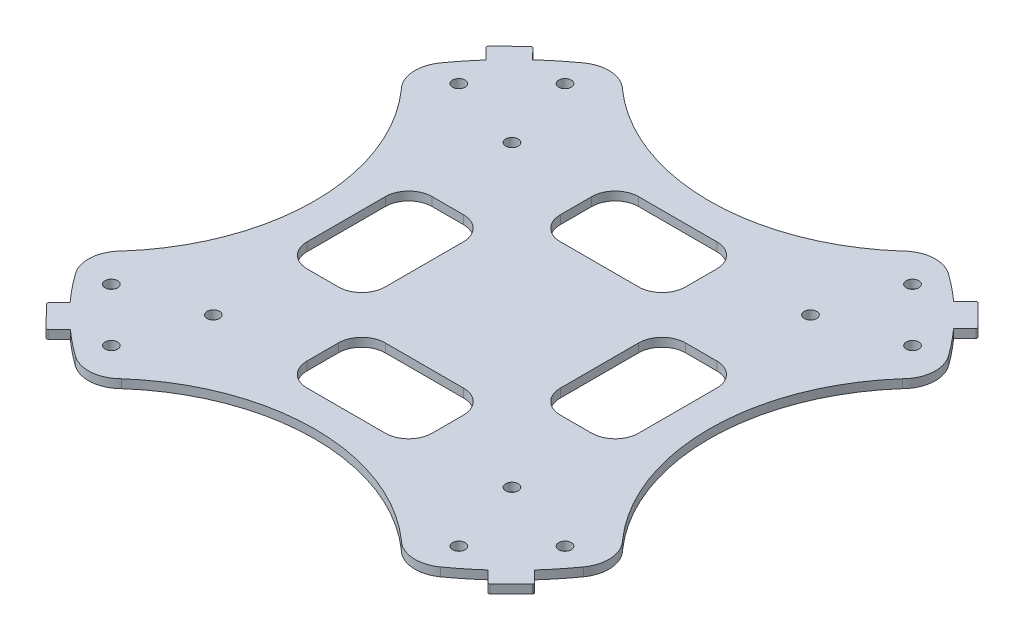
SolidWorks part; units mm, degrees
ref_plane "Front Plane" through (0, 0, 0) normal (0, 0, 1) x (1, 0, 0)
ref_plane "Top Plane" through (0, 0, 0) normal (0, 1, 0) x (1, 0, 0)
ref_plane "Right Plane" through (0, 0, 0) normal (1, 0, 0) x (0, 0, -1)
sketch "Sketch1" plane through (0, 0, 0) normal (0, 1, 0) x (1, 0, 0)
  line L0 (-1000, 0) -> (49000, 0) construction
  line L1 (0, -1000) -> (0, 49000) construction
  line L2 (707.1069, -707.1069) -> (-34648.2322, 34648.2322) construction
  line L3 (-707.1068, -707.1068) -> (34648.2323, 34648.2323) construction
  line L4 (716.0871, -698.1266) -> (0, 17.9605) construction
  line L5 (-698.1265, -716.087) -> (34657.2125, 34639.252) construction
  line L6 (698.1266, -716.0871) -> (-34657.2125, 34639.2519) construction
  line L7 (-716.087, -698.1265) -> (0, 17.9605) construction
  line L8 (-733.6258, -670.2104) -> (-31.7077, 31.7077) construction
  line L9 (733.9751, -670.5597) -> (22.7274, 40.6879) construction
  line L10 (39.5829, 36.115) -> (36.1358, 39.5583)
  line L11 (716.0871, -698.1266) -> (-34639.2519, 34657.2125) construction
  line L12 (35.7817, 39.5534) -> (33.9856, 37.7573)
  line L13 (-716.087, -698.1265) -> (34639.252, 34657.2125) construction
  line L14 (39.5739, 35.7609) -> (37.7573, 33.9856)
  line L15 (39.5382, -36.1548) -> (36.0819, -39.6111)
  line L16 (39.5078, -35.8322) -> (37.7118, -34.0362)
  line L17 (-35.9968, -39.6764) -> (-39.3444, -36.2512)
  line L18 (-37.6038, -34.1555) -> (-39.3423, -35.894)
  line L19 (35.7129, -39.6171) -> (33.9376, -37.8006)
  line L20 (-35.6141, -39.7036) -> (-33.8181, -37.9075)
  line L21 (-39.7221, 35.8999) -> (-36.251, 39.2922)
  line L22 (-34.2033, 37.5603) -> (-35.8918, 39.2881)
  line L24 (-37.9528, 33.7672) -> (-39.7242, 35.5386)
  line L30 (-39.4203, -35.9308) -> (-37.6038, -34.1555)
  line L31 (-39.7488, 35.5633) -> (-37.9528, 33.7672)
  line L32 (-35.9786, 39.3768) -> (-34.2033, 37.5603)
  arc A0 (-29.6486, 41.2505) -> (-34.2033, 37.5603) centre (0, 0) ccw construction
  arc A1 (-22.7274, 40.6879) -> (-29.6486, 41.2505) centre (-26.519, 36.8963) ccw
  arc A2 (-40.6879, 22.7274) -> (-41.2505, 29.6486) centre (-36.8963, 26.519) cw
  arc A3 (22.7274, 40.6879) -> (29.6486, 41.2505) centre (26.519, 36.8963) cw
  arc A4 (40.6879, 22.7274) -> (41.2505, 29.6486) centre (36.8963, 26.519) ccw
  arc A5 (40.6879, -22.7274) -> (41.2505, -29.6486) centre (36.8963, -26.519) cw
  arc A6 (22.7274, -40.6879) -> (29.6486, -41.2505) centre (26.519, -36.8963) ccw
  arc A7 (-22.7274, -40.6879) -> (-29.6486, -41.2505) centre (-26.519, -36.8963) cw
  arc A8 (-40.6879, -22.7274) -> (-41.2505, -29.6486) centre (-36.8963, -26.519) ccw
  arc A9 (-22.7274, 40.6879) -> (22.7274, 40.6879) centre (0, 66.2866) ccw
  arc A10 (40.6879, 22.7274) -> (40.6879, -22.7274) centre (66.2866, 0) ccw
  arc A11 (22.7274, -40.6879) -> (-22.7274, -40.6879) centre (0, -66.2866) ccw
  arc A12 (-40.6879, -22.7274) -> (-40.6879, 22.7274) centre (-66.2866, 0) ccw
  arc A13 (-29.6486, 41.2505) -> (-34.2033, 37.5603) centre (0, 0) ccw
  arc A14 (41.2505, 29.6486) -> (37.7573, 33.9856) centre (0, 0) ccw construction
  arc A15 (41.2505, 29.6486) -> (37.7573, 33.9856) centre (0, 0) ccw
  arc A16 (29.6486, -41.2505) -> (33.9376, -37.8006) centre (0, 0) ccw construction
  arc A17 (29.6486, -41.2505) -> (33.9376, -37.8006) centre (0, 0) ccw
  arc A18 (-41.2505, -29.6486) -> (-37.6038, -34.1555) centre (0, 0) ccw construction
  arc A19 (-41.2505, -29.6486) -> (-37.6038, -34.1555) centre (0, 0) ccw
  arc A20 (33.9856, 37.7573) -> (29.6486, 41.2505) centre (0, 0) ccw construction
  arc A21 (33.9856, 37.7573) -> (29.6486, 41.2505) centre (0, 0) ccw
  arc A22 (37.7118, -34.0362) -> (41.2505, -29.6486) centre (0, 0) ccw construction
  arc A23 (37.7118, -34.0362) -> (41.2505, -29.6486) centre (0, 0) ccw
  arc A24 (-33.8181, -37.9075) -> (-29.6486, -41.2505) centre (0, 0) ccw construction
  arc A25 (-33.8181, -37.9075) -> (-29.6486, -41.2505) centre (0, 0) ccw
  arc A26 (-37.9528, 33.7672) -> (-41.2505, 29.6486) centre (0, 0) ccw construction
  arc A27 (-37.9528, 33.7672) -> (-41.2505, 29.6486) centre (0, 0) ccw
  arc A28 (-35.6141, -39.7036) -> (-35.9968, -39.6764) centre (-35.7937, -39.5239) cw
  arc A29 (-39.3423, -35.894) -> (-39.3444, -36.2512) centre (-39.1627, -36.0736) ccw
  arc A30 (35.7129, -39.6171) -> (36.0819, -39.6111) centre (35.8945, -39.4396) ccw
  arc A31 (39.5078, -35.8322) -> (39.5382, -36.1548) centre (39.3282, -36.0118) cw
  arc A32 (39.5739, 35.7609) -> (39.5829, 36.115) centre (39.3964, 35.9426) ccw
  arc A33 (36.1358, 39.5583) -> (35.7817, 39.5534) centre (35.9613, 39.3738) ccw
  arc A34 (-39.7221, 35.8999) -> (-39.7242, 35.5386) centre (-39.5446, 35.7182) ccw
  arc A35 (-36.251, 39.2922) -> (-35.8918, 39.2881) centre (-36.0735, 39.1105) cw
  circle A36 centre (-28.2202, 36.8412) radius 1.016
  circle A37 centre (-36.8412, 28.2202) radius 1.016
  circle A38 centre (-24.2455, 24.2455) radius 1.016
  circle A39 centre (28.2202, 36.8412) radius 1.016
  circle A40 centre (36.8412, 28.2202) radius 1.016
  circle A41 centre (24.2455, 24.2455) radius 1.016
  circle A42 centre (36.8412, -28.2202) radius 1.016
  circle A43 centre (28.2202, -36.8412) radius 1.016
  circle A44 centre (24.2455, -24.2455) radius 1.016
  circle A45 centre (-28.2202, -36.8412) radius 1.016
  circle A46 centre (-36.8412, -28.2202) radius 1.016
  circle A47 centre (-24.2455, -24.2455) radius 1.016
  point P46 (0, 0)
  point P60 (0, 0)
  point P75 (-0.048, -0.2069)
  point P83 (41.6473, 37.8756)
  point P86 (37.8756, 41.6473)
  point P120 (0, 0)
  dimension "D1" = 12.7
  dimension "D3" = 4
  dimension "D4" = 4
  dimension "D7" = 0.254
  dimension "D8" = 50.8
  dimension "D10" = 0.254
  dimension "D9" = 0.254
  dimension "D13" = 13.208
  dimension "D5" = 2.667
  dimension "D11" = 12.192
  dimension "D12" = 7.366
  dimension "D2" = 12.7
  dimension "D6" = 4
  dimension "D14" = 4
extrude "Boss-Extrude1" add sketch "Sketch1" along normal blind 1.397
sketch "Sketch3" plane through (0, 1.397, 0) normal (0, 1, 0) x (1, 0, 0)
  line L0 (0, 0) -> (0, 50000) construction
  line L1 (26.924, 6.35) -> (26.924, -6.35)
  line L2 (-6.35, 26.924) -> (6.35, 26.924)
  line L3 (-10.16, 23.114) -> (-10.16, 18.034)
  line L4 (-6.35, 14.224) -> (6.35, 14.224)
  line L5 (10.16, 23.114) -> (10.16, 18.034)
  line L6 (-10.16, 26.924) -> (10.16, 14.224) construction
  line L7 (-10.16, 14.224) -> (10.16, 26.924) construction
  line L8 (23.114, -10.16) -> (18.034, -10.16)
  line L9 (14.224, 6.35) -> (14.224, -6.35)
  line L10 (23.114, 10.16) -> (18.034, 10.16)
  line L11 (6.35, -26.924) -> (-6.35, -26.924)
  line L12 (-10.16, -23.114) -> (-10.16, -18.034)
  line L13 (6.35, -14.224) -> (-6.35, -14.224)
  line L14 (10.16, -23.114) -> (10.16, -18.034)
  line L15 (-26.924, -6.35) -> (-26.924, 6.35)
  line L16 (-23.114, 10.16) -> (-18.034, 10.16)
  line L17 (-14.224, -6.35) -> (-14.224, 6.35)
  line L18 (-23.114, -10.16) -> (-18.034, -10.16)
  arc A0 (-10.16, 23.114) -> (-6.35, 26.924) centre (-6.35, 23.114) cw
  arc A1 (-10.16, 18.034) -> (-6.35, 14.224) centre (-6.35, 18.034) ccw
  arc A2 (10.16, 18.034) -> (6.35, 14.224) centre (6.35, 18.034) cw
  arc A3 (10.16, 23.114) -> (6.35, 26.924) centre (6.35, 23.114) ccw
  arc A4 (23.114, 10.16) -> (26.924, 6.35) centre (23.114, 6.35) cw
  arc A5 (23.114, -10.16) -> (26.924, -6.35) centre (23.114, -6.35) ccw
  arc A6 (18.034, 10.16) -> (14.224, 6.35) centre (18.034, 6.35) ccw
  arc A7 (18.034, -10.16) -> (14.224, -6.35) centre (18.034, -6.35) cw
  arc A8 (10.16, -23.114) -> (6.35, -26.924) centre (6.35, -23.114) cw
  arc A9 (-10.16, -23.114) -> (-6.35, -26.924) centre (-6.35, -23.114) ccw
  arc A10 (10.16, -18.034) -> (6.35, -14.224) centre (6.35, -18.034) ccw
  arc A11 (-10.16, -18.034) -> (-6.35, -14.224) centre (-6.35, -18.034) cw
  arc A12 (-23.114, -10.16) -> (-26.924, -6.35) centre (-23.114, -6.35) cw
  arc A13 (-23.114, 10.16) -> (-26.924, 6.35) centre (-23.114, 6.35) ccw
  arc A14 (-18.034, -10.16) -> (-14.224, -6.35) centre (-18.034, -6.35) ccw
  arc A15 (-18.034, 10.16) -> (-14.224, 6.35) centre (-18.034, 6.35) cw
  point P3 (0, 20.574)
  point P59 (0, 0)
  dimension "D3" = 26.924
  dimension "D4" = 3.81
  dimension "D1" = 12.7
  dimension "D2" = 20.32
  dimension "D5" = 4
extrude "Cut-Extrude1" cut sketch "Sketch3" against normal blind 1.397
